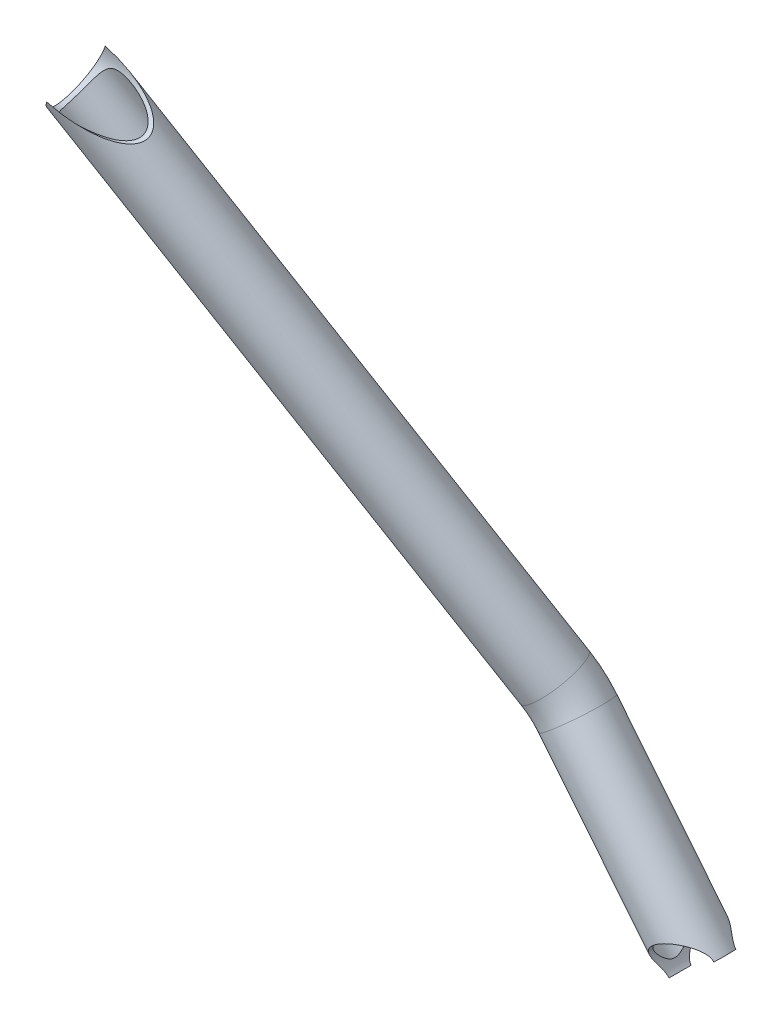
SolidWorks part; units mm, degrees
ref_plane "Plan de face" through (0, 0, 0) normal (0, 0, 1) x (1, 0, 0)
ref_plane "Plan de dessus" through (0, 0, 0) normal (0, 1, 0) x (1, 0, 0)
ref_plane "Plan de droite" through (0, 0, 0) normal (1, 0, 0) x (0, 0, -1)
sketch "Esquisse1" plane through (-85.1407, -68.8124, 0) normal (-0.7777, -0.6286, 0) x (0, 0, 1)
  line L0 (-164.2263, 2.0974) -> (-164.2263, -94.4143) construction
  line L1 (-164.2263, 2.0974) -> (-164.2263, -94.5075)
  line L2 (-95, 280.9389) -> (-162.3636, 16.9316) construction
  line L3 (-95, 280.9389) -> (-162.3636, 16.9316)
  line L14 (-179.2263, -94.5075) -> (-149.2263, -94.5075) construction
  arc A0 (-162.3636, 16.9316) -> (-164.2263, 2.0974) centre (-104.2263, 2.0974) ccw construction
  arc A1 (-162.3636, 16.9316) -> (-164.2263, 2.0974) centre (-104.2263, 2.0974) ccw
sketch "Esquisse2" plane through (59.406, -73.5024, 0) normal (-0.6286, 0.7777, 0) x (-0.7777, -0.6286, 0)
  line L0 (109.4718, -179.2263) -> (109.4718, -149.2263) construction
  line L1 (105.1718, -179.2263) -> (113.7718, -179.2263) construction
  circle A0 centre (109.4718, -164.2263) radius 15
  circle A1 centre (109.4718, -164.2263) radius 13
  dimension "D1" = 30
  dimension "D3" = 26
  dimension "D2" = 15
sweep "Balayage2" add profiles "Esquisse2" path "Esquisse1"
sketch "Esquisse3" plane through (0, 0, 0) normal (0, 0, 1) x (1, 0, 0)
  circle A0 centre (-25.7347, -142.3147) radius 14 construction
  circle A1 centre (-25.7347, -142.3147) radius 14
extrude "Enlèv. mat.-Extru.1" cut sketch "Esquisse3" against normal through all
sketch "Esquisse4" plane through (0, 0, 0) normal (1, 0, 0) x (0, 0, -1)
  line L0 (-80, 149.6853) -> (80, 149.6853) construction
  line L1 (0, -90.3147) -> (0, 149.6853) construction
  circle A0 centre (95, 149.6853) radius 15
  dimension "D1" = 30
  dimension "D2" = 95
extrude "Enlèv. mat.-Extru.2" cut sketch "Esquisse4" against normal through all
